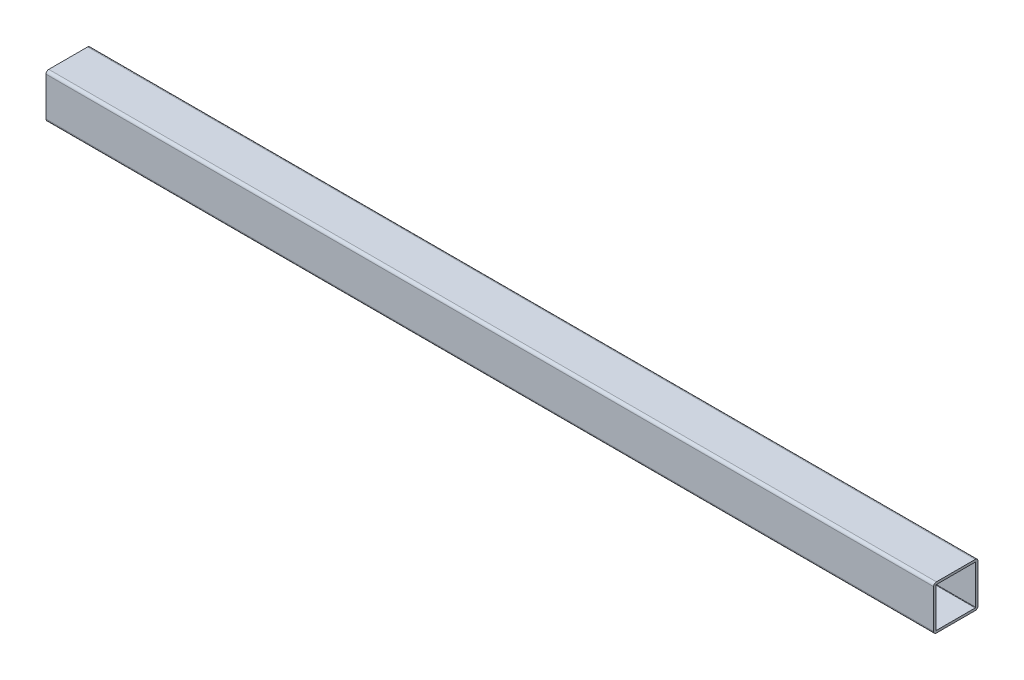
SolidWorks part; units mm, degrees
ref_plane "Front Plane" through (0, 0, 0) normal (0, 0, 1) x (1, 0, 0)
ref_plane "Top Plane" through (0, 0, 0) normal (0, 1, 0) x (1, 0, 0)
ref_plane "Right Plane" through (0, 0, 0) normal (1, 0, 0) x (0, 0, -1)
sketch "Sketch1" plane through (0, 0, 0) normal (1, 0, 0) x (0, 0, -1)
  line L0 (-5.373, 3.898) -> (16.852, 3.898)
  line L1 (-5.373, 5.2442) -> (16.852, 5.2442)
  line L2 (-6.9605, 3.6567) -> (-6.9605, -18.5683)
  line L3 (-5.373, -20.1558) -> (16.852, -20.1558)
  line L4 (18.4395, 3.6567) -> (18.4395, -18.5683)
  line L5 (17.0933, 3.6567) -> (17.0933, -18.5683)
  line L6 (-5.373, -18.8096) -> (16.852, -18.8096)
  line L7 (-5.6143, 3.6567) -> (-5.6143, -18.5683)
  arc A0 (16.852, 5.2442) -> (18.4395, 3.6567) centre (16.852, 3.6567) cw
  arc A1 (-6.9605, 3.6567) -> (-5.373, 5.2442) centre (-5.373, 3.6567) cw
  arc A2 (-5.373, -20.1558) -> (-6.9605, -18.5683) centre (-5.373, -18.5683) cw
  arc A3 (18.4395, -18.5683) -> (16.852, -20.1558) centre (16.852, -18.5683) cw
  arc A4 (16.852, 3.898) -> (17.0933, 3.6567) centre (16.852, 3.6567) cw
  arc A5 (17.0933, -18.5683) -> (16.852, -18.8096) centre (16.852, -18.5683) cw
  arc A6 (-5.373, -18.8096) -> (-5.6143, -18.5683) centre (-5.373, -18.5683) cw
  arc A7 (-5.6143, 3.6567) -> (-5.373, 3.898) centre (-5.373, 3.6567) cw
  point P6 (18.4395, 5.2442)
  point P9 (-6.9605, 5.2442)
  point P14 (18.4395, -20.1558)
  dimension "D3" = 1.5875
  dimension "D1" = 25.4
  dimension "D2" = 25.4
  dimension "D4" = 1.3462
extrude "Extrude1" add sketch "Sketch1" along normal blind 508
